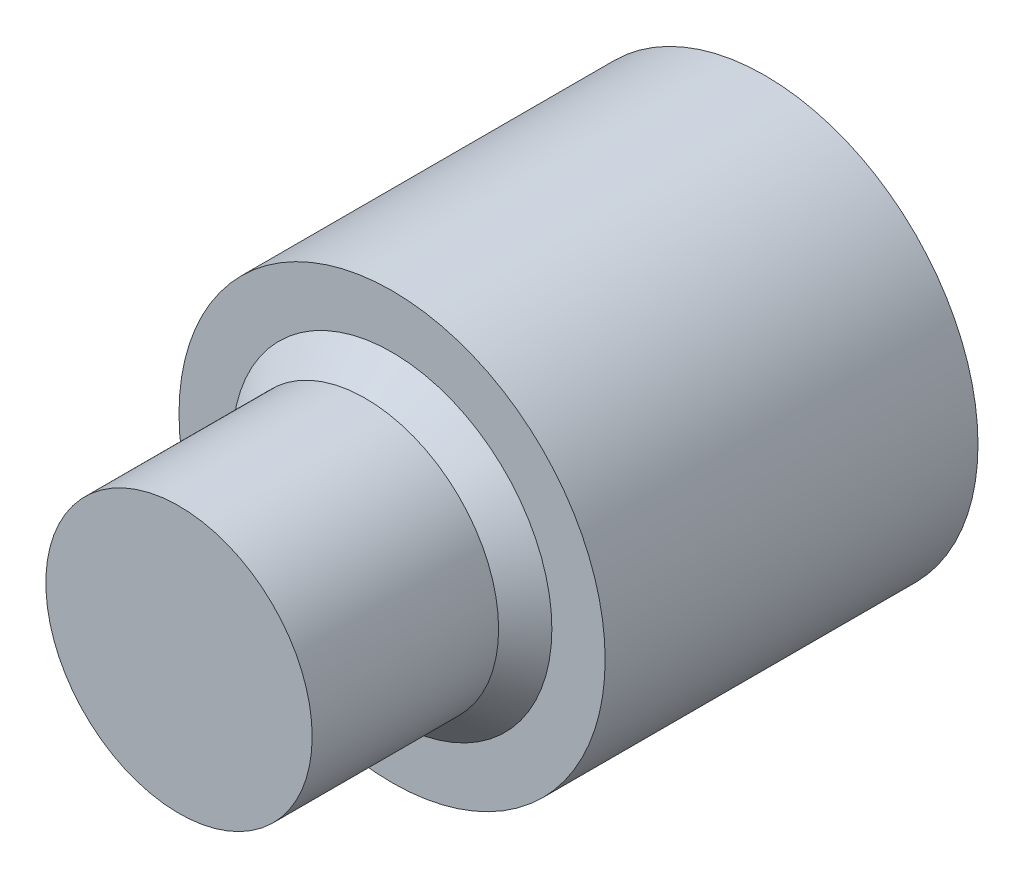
SolidWorks part; units mm, degrees
ref_plane "Ön Düzlem" through (0, 0, 0) normal (0, 0, 1) x (1, 0, 0)
ref_plane "Üst Düzlem" through (0, 0, 0) normal (0, 1, 0) x (1, 0, 0)
ref_plane "Sağ Düzlem" through (0, 0, 0) normal (1, 0, 0) x (0, 0, -1)
sketch "Çizim1" plane through (0, 0, 0) normal (0, 0, 1) x (1, 0, 0)
  circle A0 centre (0, 0) radius 4
  dimension "D1" = 8
extrude "Yükseklik-Ekstrüzyon1" add sketch "Çizim1" along normal blind 7
sketch "Çizim2" plane through (0, 0, 7) normal (0, 0, 1) x (1, 0, 0)
  circle A0 centre (0, 0) radius 3
  dimension "D1" = 6
extrude "Yükseklik-Ekstrüzyon2" add sketch "Çizim2" along normal blind 0.5 draft 45
sketch "Çizim3" plane through (0, 0, 7.5) normal (0, 0, 1) x (1, 0, 0)
  circle A0 centre (0, 0) radius 2.5
extrude "Yükseklik-Ekstrüzyon3" add sketch "Çizim3" along normal blind 3.5
